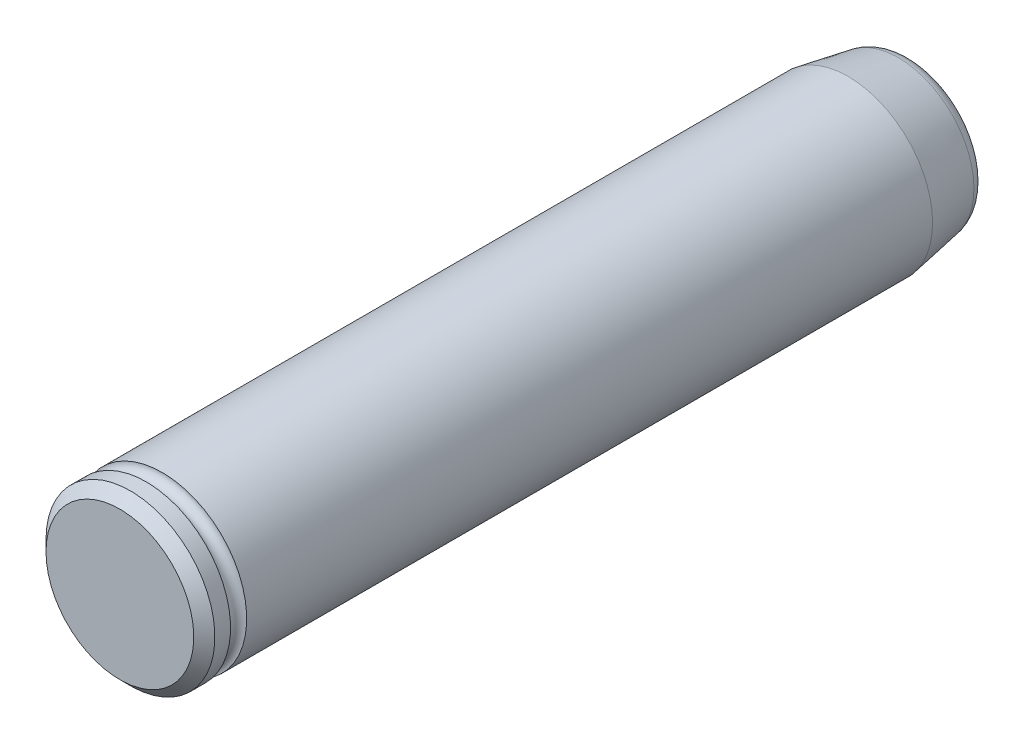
SolidWorks part; units mm, degrees
ref_plane "Frontal" through (0, 0, 0) normal (0, 0, 1) x (1, 0, 0)
ref_plane "Horizontal" through (0, 0, 0) normal (0, 1, 0) x (1, 0, 0)
ref_plane "Profil" through (0, 0, 0) normal (1, 0, 0) x (0, 0, -1)
sketch "Esquisse1" plane through (0, 0, 0) normal (0, 0, 1) x (1, 0, 0)
  circle A0 centre (0, 0) radius 16
  dimension "D1" = 32
extrude "Base-Extrusion" add sketch "Esquisse1" along normal blind 150
chamfer "Chanfrein1" distance 2 angle 45
chamfer "Chanfrein2" distance 12 angle 10
fillet "Congé1" radius 3
sketch "Esquisse2" plane through (0, 0, 0) normal (0, 1, 0) x (1, 0, 0)
  line L0 (0, 0) -> (0, -210.5788) construction
  line L1 (0, -148) -> (0, -12) construction
  line L2 (16, -148) -> (16, -12) construction
  line L3 (-14, -150) -> (14, -150) construction
  circle A0 centre (16, -143.5) radius 1.525
  dimension "D1" = 3.05
  dimension "D2" = 6.5
revolve "Enlèvement de matière-Révolution1" cut sketch "Esquisse2" angle 360 about L0
